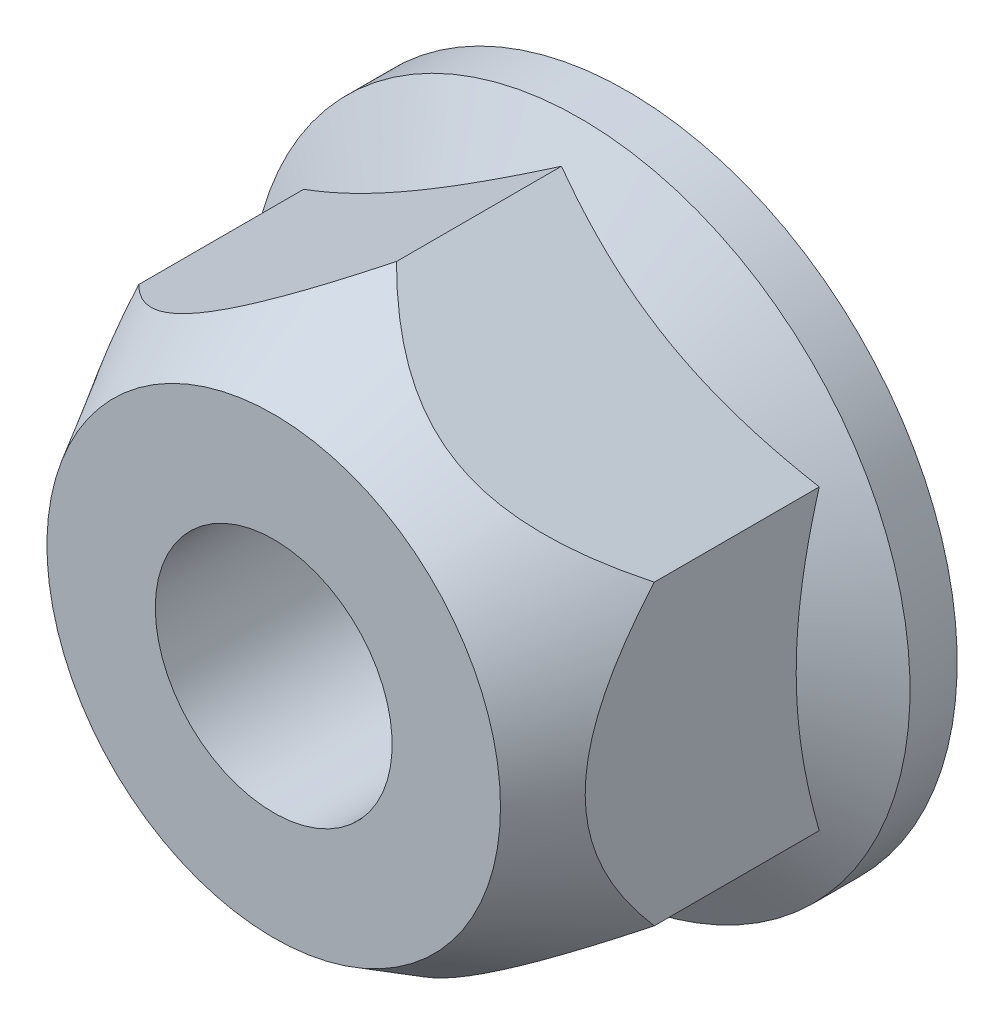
SolidWorks part; units mm, degrees
ref_plane "Front Plane" through (0, 0, 0) normal (0, 0, 1) x (1, 0, 0)
ref_plane "Top Plane" through (0, 0, 0) normal (0, 1, 0) x (1, 0, 0)
ref_plane "Right Plane" through (0, 0, 0) normal (1, 0, 0) x (0, 0, -1)
sketch "BaseNutSke" plane through (0, 0, 0) normal (1, 0, 0) x (0, 0, -1)
  line L0 (0, 0) -> (-14349.029, 0) construction
  line L1 (-7.62, 2.5527) -> (-7.62, 5.5562)
  line L2 (-7.62, 5.5562) -> (-1.9142, 5.5562)
  line L4 (-1.9142, 5.5562) -> (-1.016, 7.112)
  line L5 (-1.016, 7.112) -> (0, 7.112)
  line L6 (0, 7.112) -> (0, 2.5527)
  line L7 (0, 2.5527) -> (-7.62, 2.5527)
  point P7 (-0.508, 7.112)
revolve "BaseNut" add sketch "BaseNutSke" angle 360 about L0
sketch "HexSke" plane through (0, 0, 0) normal (0, 0, 1) x (1, 0, 0)
  line L1 (5.5562, -3.2079) -> (5.5562, 3.2079)
  line L2 (5.5562, 3.2079) -> (0, 6.4158)
  line L3 (0, 6.4158) -> (-5.5562, 3.2079)
  line L4 (-5.5562, 3.2079) -> (-5.5562, -3.2079)
  line L5 (-5.5562, -3.2079) -> (0, -6.4158)
  line L6 (0, -6.4158) -> (5.5562, -3.2079)
  circle A0 centre (0, 0) radius 5.5562 construction
  circle A2 centre (0, 0) radius 5.5562 construction
  circle A3 centre (0, 0) radius 2.5527 construction
  circle A4 centre (0, 0) radius 2.5527
extrude "Hex" add sketch "HexSke" along normal up to surface (7.62 mm away)
sketch "FilletSke" plane through (0, 0, 0) normal (1, 0, 0) x (0, 0, -1)
  line L0 (-7.62, 6.4158) -> (-7.62, 4.8881)
  line L2 (-7.62, 4.8881) -> (-4.9739, 6.4158)
  line L3 (-7.62, 6.4158) -> (-1.4179, 6.4158) construction
  line L4 (-4.9739, 6.4158) -> (-7.62, 6.4158)
  line L5 (-7.62, 6.4158) -> (-7.62, 3.2079) construction
  line L11 (0, -7.112) -> (0, 7.112) construction
  line L14 (0, 0) -> (-50000, 0) construction
  point P24 (0, 0)
  dimension "D" = 3.556
  dimension "D2" = 30
revolve "HexFillet" cut sketch "FilletSke" angle 360 about axis through (0, 0, 0) along (0, 0, -1)
sketch "ThdSchSke" plane through (0, 0, 0) normal (1, 0, 0) x (0, 0, -1)
  line L0 (-0.3593, 2.5527) -> (0, 3.175)
  line L1 (0, 3.175) -> (0.3593, 2.5527)
  line L2 (0.3593, 2.5527) -> (-0.3593, 2.5527)
  line L3 (0, 2.6384) -> (0, 50002.6384) construction
  line L6 (0, 2.5527) -> (-7.62, 2.5527) construction
  line L8 (0, 0) -> (-50000, 0) construction
  line L9 (0, -7.112) -> (0, 7.112) construction
  point P18 (0, 0)
revolve "ThreadSchematic" cut sketch "ThdSchSke" angle 360 about L8
pattern_linear "ThdSchPat" [suppressed] count 11
equation "\"D1@ThdSchPat\" =  ( \"C@BaseNutSke\" / \"D3@ThdSchSke\" )  + 1"
